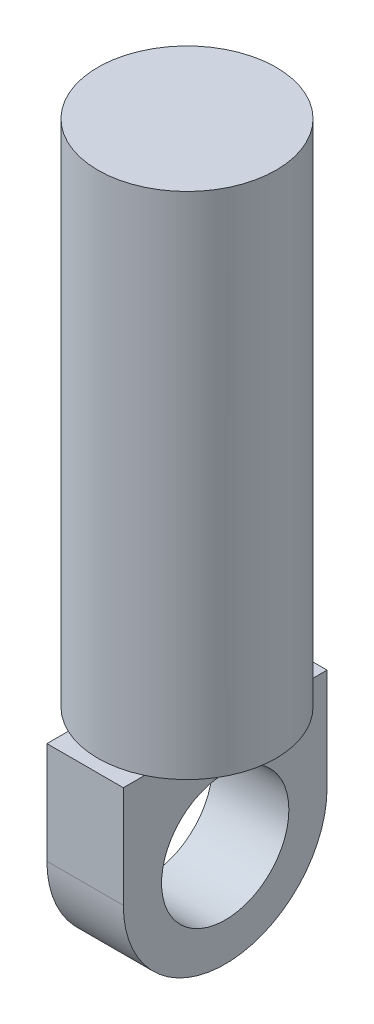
SolidWorks part; units mm, degrees
ref_plane "Front Plane" through (0, 0, 0) normal (0, 0, 1) x (1, 0, 0)
ref_plane "Top Plane" through (0, 0, 0) normal (0, 1, 0) x (1, 0, 0)
ref_plane "Right Plane" through (0, 0, 0) normal (1, 0, 0) x (0, 0, -1)
sketch "Sketch1" plane through (0, 0, 0) normal (1, 0, 0) x (0, 0, -1)
  line L0 (-100, 0) -> (-100, 100)
  line L1 (-100, 100) -> (100, 100)
  line L2 (100, 100) -> (100, 0)
  circle A0 centre (0, 0) radius 62.5
  arc A1 (-100, 0) -> (100, 0) centre (0, 0) ccw
  dimension "D1" = 125
  dimension "D2" = 200
extrude "Boss-Extrude1" add sketch "Sketch1" along normal mid plane 75
sketch "Sketch2" plane through (0, 100, 0) normal (0, 1, 0) x (1, 0, 0)
  circle A0 centre (0, 0) radius 112.5
  circle A1 centre (0, 0) radius 87.5
  dimension "D1" = 225
  dimension "D2" = 175
extrude "Boss-Extrude2" add sketch "Sketch2" along normal blind 500 contours A1 M3 | A1 M3 M1 | A1 M1 | A0
